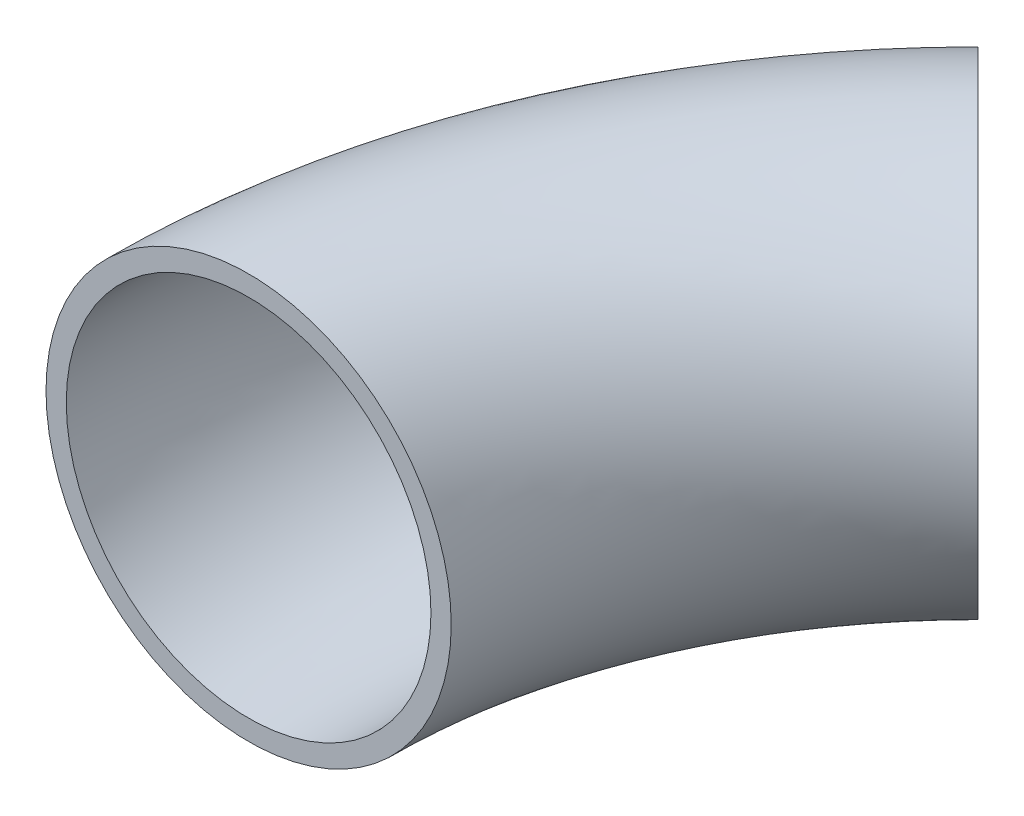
SolidWorks part; units mm, degrees
ref_plane "Plan de face" through (0, 0, 0) normal (0, 0, 1) x (1, 0, 0)
ref_plane "Plan de dessus" through (0, 0, 0) normal (0, 1, 0) x (1, 0, 0)
ref_plane "Plan de droite" through (0, 0, 0) normal (1, 0, 0) x (0, 0, -1)
sketch "Esquisse1" plane through (0, 0, 0) normal (0, 0, 1) x (1, 0, 0)
  circle A0 centre (0, 0) radius 15
  dimension "D1" = 30
sketch "Esquisse2" plane through (0, 0, 0) normal (0, 1, 0) x (1, 0, 0)
  line L0 (0, 0) -> (0, -33.9796) construction
  line L1 (0, 0) -> (25.994, 0) construction
  line L2 (24.7719, 54) -> (2.8324, 54) construction
  line L3 (54, 0) -> (-9.7636, 63.7636) construction
  arc A0 (0, 0) -> (15.8162, 38.1838) centre (54, 0) cw
  dimension "D1" = 54
  dimension "D2" = 45
sweep "Balayage-Mince2" add profiles "Esquisse1" path "Esquisse2" parameters "D1"=1.5
